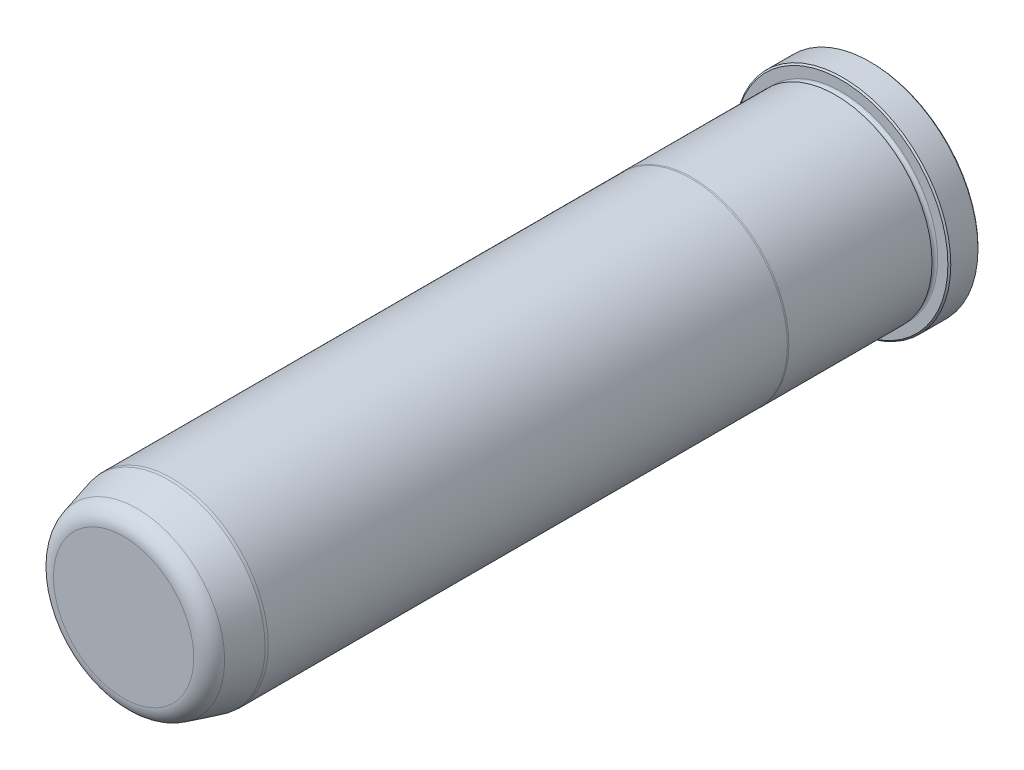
SolidWorks part; units mm, degrees
ref_plane "Front Plane" through (0, 0, 0) normal (0, 0, 1) x (1, 0, 0)
ref_plane "Top Plane" through (0, 0, 0) normal (0, 1, 0) x (1, 0, 0)
ref_plane "Right Plane" through (0, 0, 0) normal (1, 0, 0) x (0, 0, -1)
sketch "Sketch1" plane through (0, 0, 0) normal (1, 0, 0) x (0, 0, -1)
  line L0 (0, 0) -> (0, 28.448)
  line L1 (0, 28.448) -> (-7.9248, 28.448)
  line L2 (-7.9248, 28.448) -> (-7.9248, 25.3873)
  line L3 (-7.9248, 24.6253) -> (-9.4488, 24.6253) construction
  line L4 (-9.4488, 25.3873) -> (-9.4488, 25.4127)
  line L5 (-9.4488, 25.4127) -> (-47.1348, 25.4127)
  line L6 (-47.1348, 25.4127) -> (-47.498, 25.3873)
  line L7 (-47.498, 25.3873) -> (-184.15, 25.3873)
  line L9 (-196.85, 22.1219) -> (-196.85, 0)
  line L10 (-196.85, 0) -> (0, 0)
  line L11 (0, 0) -> (13.6287, 0) construction
  line L12 (-184.15, 25.3873) -> (-184.912, 25.3206)
  line L13 (-184.912, 25.3206) -> (-196.85, 22.1219)
  arc A0 (-9.4488, 25.3873) -> (-7.9248, 25.3873) centre (-8.6868, 25.3873) ccw
  dimension "D14" = 1.524
  dimension "D1" = 7.9248
  dimension "D2" = 1.524
  dimension "D3" = 56.896
  dimension "D4" = 50.8254
  dimension "D5" = 47.498
  dimension "D6" = 196.85
  dimension "D7" = 0.7874
  dimension "D8" = 4
  dimension "D9" = 50.7746
  dimension "D10" = 5
  dimension "D11" = 15
  dimension "D12" = 0.762
  dimension "D13" = 12.7
revolve "Revolve1" add sketch "Sketch1" angle 360 about L11
fillet "Fillet6" radius 4.7625 1 edges at (22.1219, 0, 196.85)
chamfer "Chamfer1" distance 0.381 angle 45 2 edges at (28.448, 0, 0) (28.448, 0, 7.9248)
